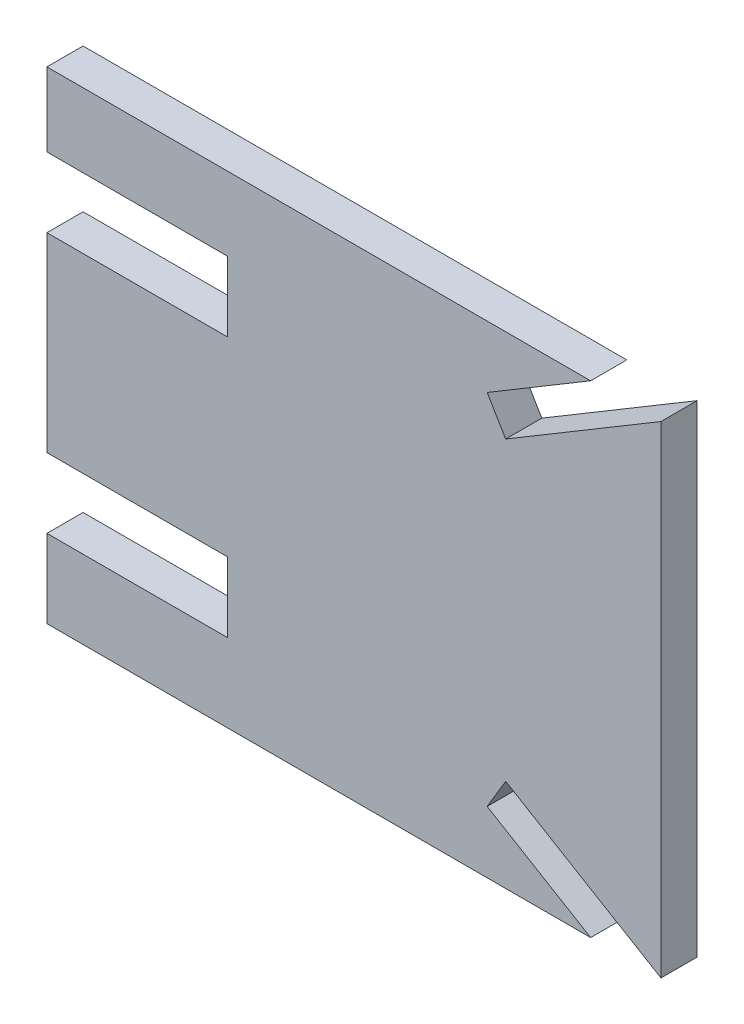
SolidWorks part; units mm, degrees
ref_plane "Alzado" through (0, 0, 0) normal (0, 0, 1) x (1, 0, 0)
ref_plane "Planta" through (0, 0, 0) normal (0, 1, 0) x (1, 0, 0)
ref_plane "Vista lateral" through (0, 0, 0) normal (1, 0, 0) x (0, 0, -1)
sketch "Croquis1" plane through (0, 0, 0) normal (0, 0, 1) x (1, 0, 0)
  line L0 (-22.5527, 13.7) -> (-7.5527, 13.7)
  line L1 (22.5527, -20.1881) -> (-22.5527, -20.1881)
  line L2 (28.3836, -20.1773) -> (28.3836, 19.8008)
  line L3 (22.5527, 19.8115) -> (-22.5527, 19.8115)
  line L4 (-22.5527, -20.1881) -> (-22.5527, -13.7)
  line L7 (-7.5527, 13.7) -> (-7.5527, 7.9)
  line L8 (-7.5527, 7.9) -> (-22.5527, 7.9)
  line L9 (-22.5527, -7.9) -> (-7.5527, -7.9)
  line L10 (-7.5527, -7.9) -> (-7.5527, -13.7)
  line L11 (-7.5527, -13.7) -> (-22.5527, -13.7)
  line L12 (-22.5527, 13.7) -> (-22.5527, 19.8115)
  line L13 (-22.5527, -7.9) -> (-22.5527, 7.9)
  line L14 (22.5527, 19.8115) -> (13.9683, 14.6824)
  line L15 (13.9683, 14.6824) -> (15.507, 12.1071)
  line L16 (15.507, 12.1071) -> (28.3836, 19.8008)
  line L17 (2.5, -0.1883) -> (28.3836, -0.1883) construction
  line L18 (15.507, -12.4836) -> (28.3836, -20.1773)
  line L19 (13.9683, -15.059) -> (15.507, -12.4836)
  line L20 (22.5527, -20.1881) -> (13.9683, -15.059)
  point P0 (0, 0)
  point P3 (0, 19.8115)
  point P12 (-22.5527, 0)
  point P22 (0, -20.1881)
  dimension "D1" = 5.8
  dimension "D2" = 5.8
  dimension "D3" = 15
  dimension "D4" = 15
  dimension "D5" = 50.9363
  dimension "D7" = 15.8
  dimension "D8" = 3
  dimension "D9" = 15
  dimension "D10" = 10
extrude "Saliente-Extruir1" add sketch "Croquis1" along normal blind 3
